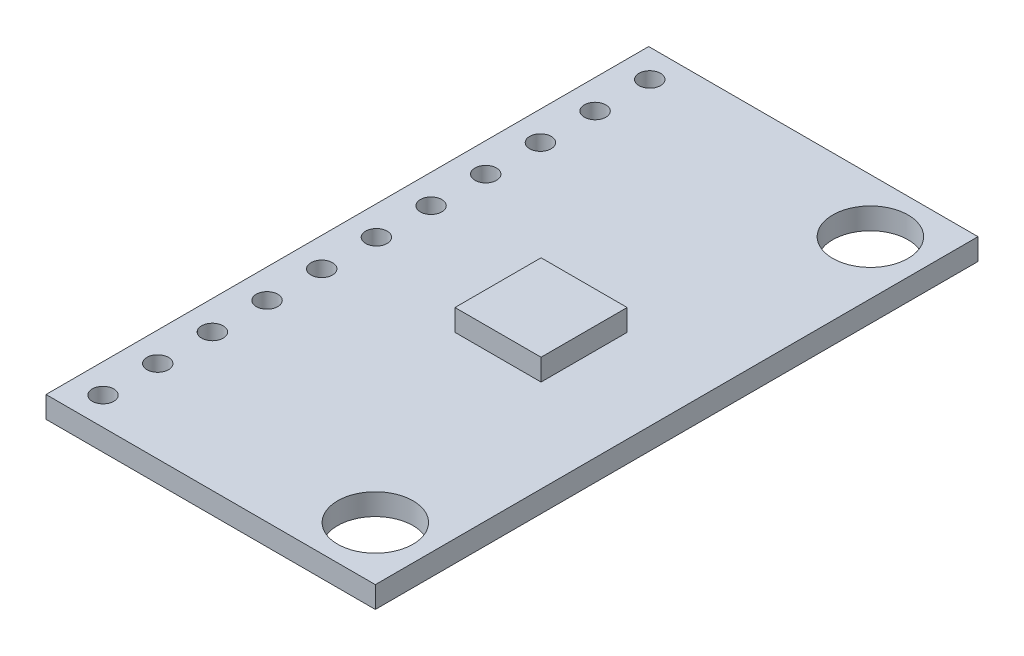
SolidWorks part; units mm, degrees
ref_plane "Front" through (0, 0, 0) normal (0, 0, 1) x (1, 0, 0)
ref_plane "Top" through (0, 0, 0) normal (0, 1, 0) x (1, 0, 0)
ref_plane "Right" through (0, 0, 0) normal (1, 0, 0) x (0, 0, -1)
sketch "Sketch1" plane through (0, 0, 0) normal (0, 1, 0) x (1, 0, 0)
  line L0 (-180.9375, 131.4064) -> (-115.2399, 131.4064) construction
  line L1 (-21.6761, 0) -> (19.2384, 0) construction
  line L2 (-2, -2) -> (2, -2) construction
  line L3 (-2, -2) -> (-2, 2) construction
  line L4 (-2, 2) -> (2, 2) construction
  line L5 (2, -2) -> (2, 2) construction
  line L6 (-2, -2) -> (2, 2) construction
  line L7 (-2, 2) -> (2, -2) construction
  line L8 (-7.65, 0) -> (-7.65, 2.54) construction
  line L9 (-9, -14) -> (6.3, -14)
  line L10 (-9, -14) -> (-9, 14)
  line L11 (-9, 14) -> (6.3, 14)
  line L12 (6.3, -14) -> (6.3, 14)
  line L13 (-9, -14) -> (6.3, 14) construction
  line L14 (-9, 14) -> (6.3, -14) construction
  circle A0 centre (3.8, 11.5) radius 1.75
  circle A1 centre (3.8, -11.5) radius 1.75
  circle A2 centre (-7.65, 0) radius 0.5
  circle A3 centre (-7.65, 2.54) radius 0.5
  circle A4 centre (-7.65, 5.08) radius 0.5
  circle A5 centre (-7.65, 7.62) radius 0.5
  circle A6 centre (-7.65, 10.16) radius 0.5
  circle A7 centre (-7.65, 12.7) radius 0.5
  circle A8 centre (-7.65, -12.7) radius 0.5
  circle A9 centre (-7.65, -10.16) radius 0.5
  circle A10 centre (-7.65, -7.62) radius 0.5
  circle A11 centre (-7.65, -5.08) radius 0.5
  circle A12 centre (-7.65, -2.54) radius 0.5
  point P2 (0, 0)
  point P9 (-1.35, 0)
  dimension "D6" = 3.5
  dimension "D9" = 1
  dimension "D1" = 4
  dimension "D2" = 4
  dimension "D3" = 28
  dimension "D4" = 6.3
  dimension "D5" = 15.3
  dimension "D7" = 2.5
  dimension "D8" = 2.5
  dimension "D10" = 1.35
  dimension "D12" = 2.54
  dimension "D11" = 6
extrude "Boss-Extrude1" add sketch "Sketch1" along normal blind 1
sketch "Sketch2" plane through (0, 1, 0) normal (0, 1, 0) x (1, 0, 0)
  line L1 (-2, 2) -> (2, 2)
  line L2 (-2, 2) -> (-2, -2)
  line L3 (-2, -2) -> (2, -2)
  line L4 (2, 2) -> (2, -2)
  line L5 (-2, 2) -> (2, -2) construction
  line L6 (-2, -2) -> (2, 2) construction
extrude "Boss-Extrude2" add sketch "Sketch2" along normal blind 1
